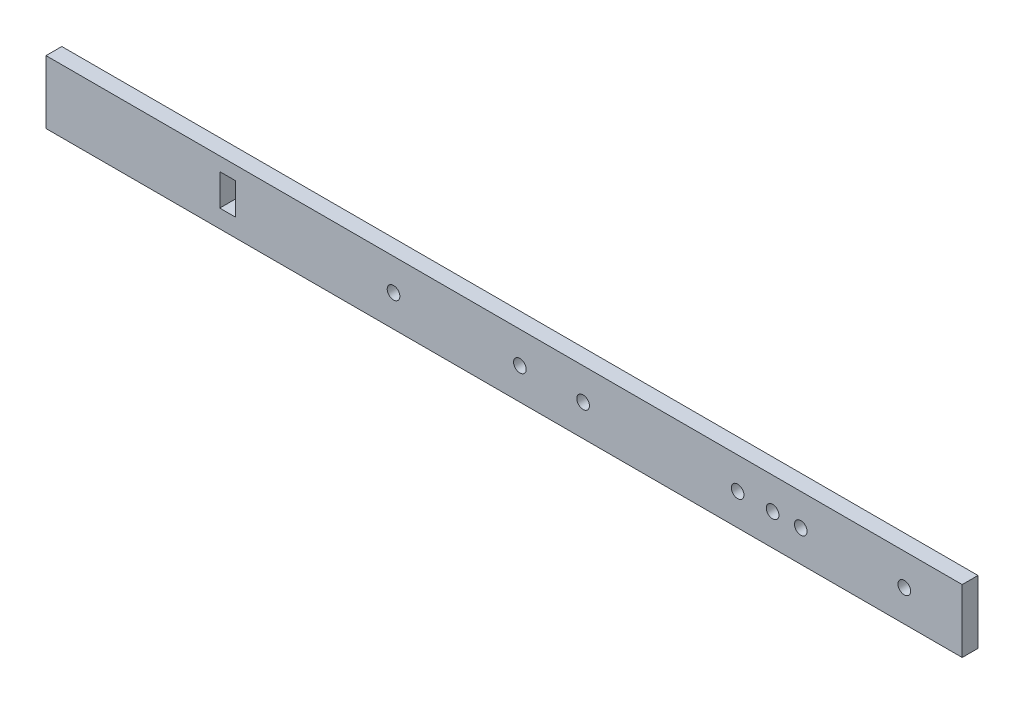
SolidWorks part; units mm, degrees
ref_plane "Front Plane" through (0, 0, 0) normal (0, 0, 1) x (1, 0, 0)
ref_plane "Top Plane" through (0, 0, 0) normal (0, 1, 0) x (1, 0, 0)
ref_plane "Right Plane" through (0, 0, 0) normal (1, 0, 0) x (0, 0, -1)
sketch "Sketch1" plane through (0, 0, 0) normal (0, 0, 1) x (1, 0, 0)
  line L1 (-110, 10) -> (180, 10)
  line L2 (-110, 10) -> (-110, -10)
  line L3 (-110, -10) -> (180, -10)
  line L4 (180, 10) -> (180, -10)
extrude "Boss-Extrude1" add sketch "Sketch1" along normal blind 5
sketch "Sketch2" plane through (0, 0, 5) normal (0, 0, 1) x (1, 0, 0)
  line L1 (-55, 5.6988) -> (-50, 5.6988)
  line L2 (-55, 5.6988) -> (-55, -4.3012)
  line L3 (-55, -4.3012) -> (-50, -4.3012)
  line L4 (-50, 5.6988) -> (-50, -4.3012)
  circle A0 centre (0, 0) radius 2
  circle A1 centre (128.9104, 0) radius 2
  circle A2 centre (60, 0) radius 2
  circle A3 centre (40, 0) radius 2
  circle A4 centre (120, 0) radius 2
  circle A5 centre (108.9104, 0) radius 2
  circle A6 centre (161.6669, 0) radius 2
  dimension "D1" = 60
  dimension "D2" = 40
  dimension "D3" = 41.6669
  dimension "D4" = 32.7565
  dimension "D5" = 60
  dimension "D6" = 20
  dimension "D10" = 10
  dimension "D11" = 5
  dimension "D12" = 50
extrude "Cut-Extrude1" cut sketch "Sketch2" against normal blind 5
sketch "Sketch3" plane through (0, 0, 5) normal (0, 0, 1) x (1, 0, 0)
  line L0 (-110, 0) -> (180, 0)
  line L1 (-110, 10) -> (-110, -10) construction
  line L2 (180, -10) -> (180, 10) construction
